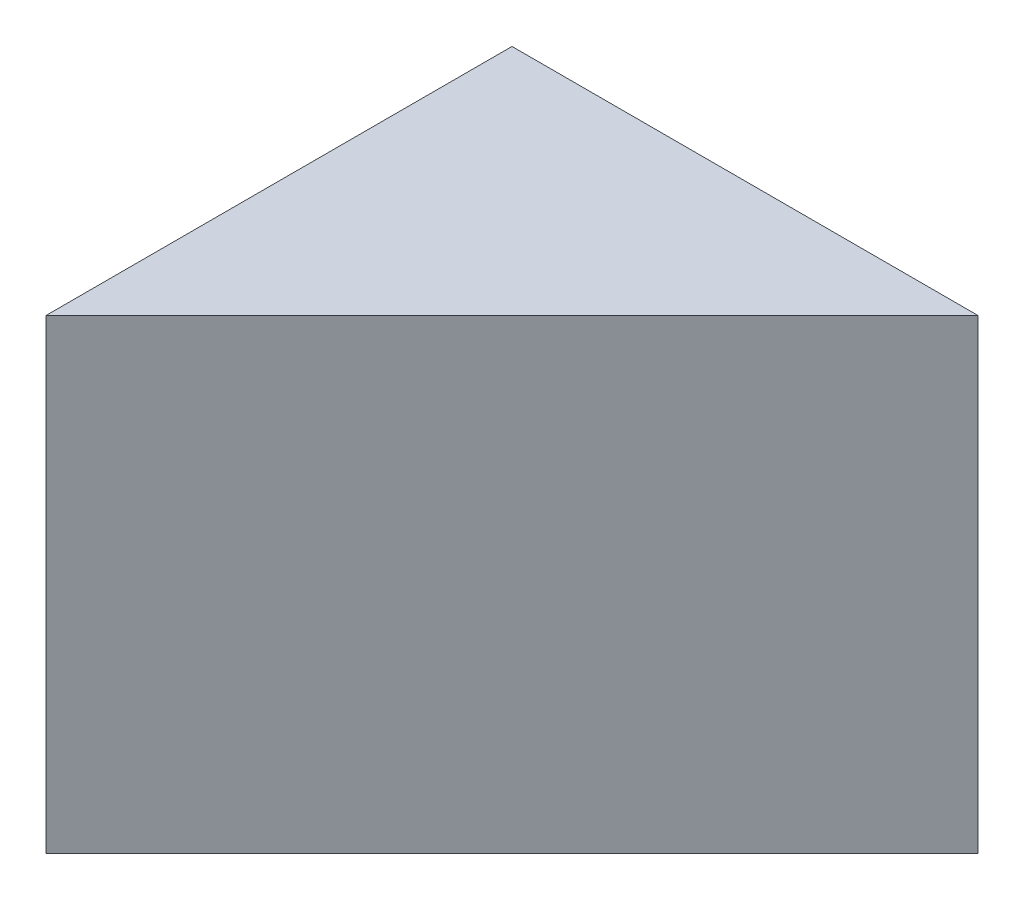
SolidWorks part; units mm, degrees
ref_plane "前视基准面" through (0, 0, 0) normal (0, 0, 1) x (1, 0, 0)
ref_plane "上视基准面" through (0, 0, 0) normal (0, 1, 0) x (1, 0, 0)
ref_plane "右视基准面" through (0, 0, 0) normal (1, 0, 0) x (0, 0, -1)
other "Configuration Table"
sketch "草图1" plane through (0, 0, 0) normal (0, 1, 0) x (1, 0, 0)
  line L0 (-30, -30) -> (30, 30)
  line L1 (-30, 30) -> (30, 30)
  line L2 (-30, 30) -> (-30, -30)
  line L3 (-30, -30) -> (30, -30)
  line L4 (30, 30) -> (30, -30)
  line L5 (-30, 30) -> (30, -30) construction
  line L6 (-30, -30) -> (30, 30) construction
  point P0 (0, 0)
extrude "凸台-拉伸1" add sketch "草图1" along normal blind 60 contours L1 L2 L0
